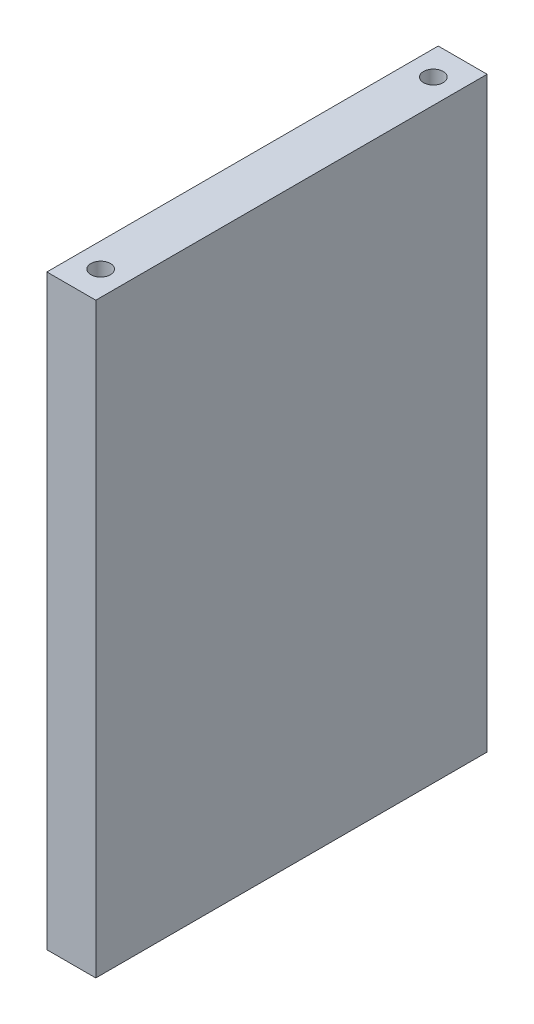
SolidWorks part; units mm, degrees
ref_plane "Plan de face" through (0, 0, 0) normal (0, 0, 1) x (1, 0, 0)
ref_plane "Plan de dessus" through (0, 0, 0) normal (0, 1, 0) x (1, 0, 0)
ref_plane "Plan de droite" through (0, 0, 0) normal (1, 0, 0) x (0, 0, -1)
sketch "Esquisse1" plane through (0, 0, 0) normal (0, 0, 1) x (1, 0, 0)
  line L1 (0, 0) -> (10, 0)
  line L2 (0, 0) -> (0, 120)
  line L3 (0, 120) -> (10, 120)
  line L4 (10, 0) -> (10, 120)
  dimension "D1" = 10
  dimension "D2" = 120
extrude "Extrusion1" add sketch "Esquisse1" against normal blind 80
sketch "Esquisse2" plane through (0, 120, 0) normal (0, 1, 0) x (-1, 0, 0)
  line L0 (-5, -87.5435) -> (-5, -1.4567) construction
  line L1 (-12.6279, -40) -> (3.2506, -40) construction
  line L2 (-10, -80) -> (0, -80) construction
  circle A0 centre (-5, -74) radius 2
  circle A1 centre (-5, -6) radius 2
  dimension "D1" = 4
  dimension "D3" = 4
  dimension "D2" = 6
  dimension "D4" = 68
extrude "Enlèv. mat.-Extru.1" cut sketch "Esquisse2" against normal blind 10
sketch "Esquisse4" plane through (0, 0, 0) normal (0, -1, 0) x (1, 0, 0)
  line L0 (0, -80) -> (10, -80) construction
  circle A0 centre (4.9744, -74) radius 2
  circle A1 centre (4.9744, -6) radius 2
  dimension "D1" = 4
  dimension "D3" = 4
  dimension "D2" = 6
  dimension "D4" = 68
extrude "Enlèv. mat.-Extru.2" cut sketch "Esquisse4" against normal blind 10
